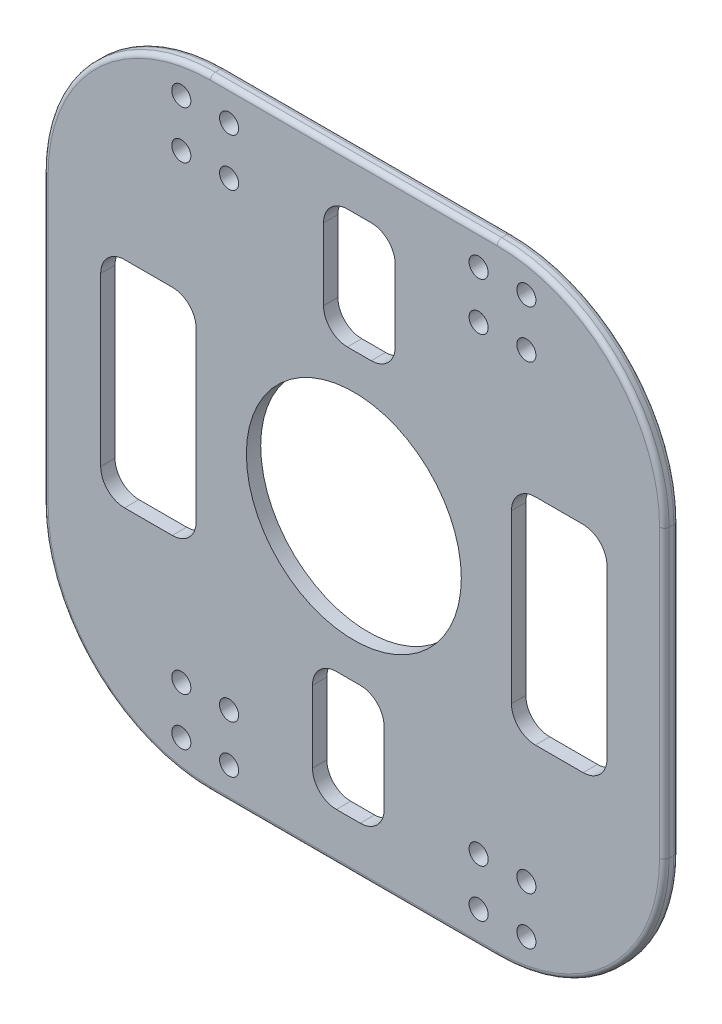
SolidWorks part; units mm, degrees
ref_plane "前视基准面" through (0, 0, 0) normal (0, 0, 1) x (1, 0, 0)
ref_plane "上视基准面" through (0, 0, 0) normal (0, 1, 0) x (1, 0, 0)
ref_plane "右视基准面" through (0, 0, 0) normal (1, 0, 0) x (0, 0, -1)
sketch "草图1" plane through (0, 0, 0) normal (0, 0, 1) x (1, 0, 0)
  line L1 (-65, 65) -> (65, 65)
  line L2 (-65, 65) -> (-65, -65)
  line L3 (-65, -65) -> (65, -65)
  line L4 (65, 65) -> (65, -65)
  line L5 (-65, 65) -> (65, -65) construction
  line L6 (-65, -65) -> (65, 65) construction
  circle A0 centre (0, 0) radius 22.5
  point P0 (0, 0)
extrude "凸台-拉伸1" add sketch "草图1" against normal blind 3
fillet "圆角1" radius 35 4 edges at (65, 65, -1.5) (-65, 65, -1.5) (65, -65, -1.5) (-65, -65, -1.5)
sketch "草图5" plane through (0, 0, -3) normal (0, 0, -1) x (-1, 0, 0)
  line L0 (0, 0) -> (0, 32.9111) construction
  line L1 (6.3448, 30) -> (6.3448, 55)
  line L2 (6.3448, 55) -> (-8.6552, 55)
  line L3 (-8.6552, 55) -> (-8.6552, 30)
  line L4 (-8.6552, 30) -> (6.3448, 30)
  line L5 (0, 0) -> (7.9061, 0) construction
  line L6 (-65, -30) -> (-65, 30) construction
  line L7 (-53, 22.5) -> (-33, 22.5)
  line L8 (-53, 22.5) -> (-53, -22.5)
  line L9 (-53, -22.5) -> (-33, -22.5)
  line L10 (-6.3448, -30) -> (-6.3448, -55)
  line L11 (-6.3448, -55) -> (8.6552, -55)
  line L12 (8.6552, -55) -> (8.6552, -30)
  line L13 (8.6552, -30) -> (-6.3448, -30)
  line L15 (-33, 22.5) -> (-33, -22.5)
  line L16 (33, 22.5) -> (33, -22.5)
  line L17 (53, -22.5) -> (33, -22.5)
  line L18 (53, 22.5) -> (53, -22.5)
  line L19 (53, 22.5) -> (33, 22.5)
  circle A1 centre (36.1191, 58.1968) radius 2
  circle A2 centre (36.1191, 58.1968) radius 2
  circle A3 centre (36.1191, 48.1968) radius 2
  circle A4 centre (36.1191, 48.1968) radius 2
  circle A7 centre (-36.1191, -58.1968) radius 2
  circle A8 centre (-36.1191, -58.1968) radius 2
  circle A15 centre (26.1191, 58.1968) radius 2
  circle A16 centre (26.1191, 58.1968) radius 2
  circle A23 centre (26.1191, 48.1968) radius 2
  circle A24 centre (26.1191, 48.1968) radius 2
  circle A33 centre (26.1191, -58.1968) radius 2
  circle A34 centre (26.1191, -58.1968) radius 2
  circle A41 centre (36.1191, -48.1968) radius 2
  circle A42 centre (36.1191, -48.1968) radius 2
  circle A43 centre (36.1191, -58.1968) radius 2
  circle A44 centre (36.1191, -58.1968) radius 2
  circle A45 centre (-36.1191, -48.1968) radius 2
  circle A46 centre (-36.1191, -48.1968) radius 2
  circle A53 centre (-26.1191, -58.1968) radius 2
  circle A54 centre (-26.1191, -58.1968) radius 2
  circle A57 centre (26.1191, -48.1968) radius 2
  circle A58 centre (26.1191, -48.1968) radius 2
  circle A63 centre (-26.1191, -48.1968) radius 2
  circle A64 centre (-26.1191, -48.1968) radius 2
  circle A83 centre (-36.1191, 48.1968) radius 2
  circle A84 centre (-36.1191, 48.1968) radius 2
  circle A85 centre (-36.1191, 58.1968) radius 2
  circle A86 centre (-36.1191, 58.1968) radius 2
  circle A91 centre (-26.1191, 58.1968) radius 2
  circle A92 centre (-26.1191, 58.1968) radius 2
  circle A93 centre (-26.1191, 48.1968) radius 2
  circle A94 centre (-26.1191, 48.1968) radius 2
  point P32 (0, 0)
  dimension "D6" = 20
  dimension "D7" = 45
  dimension "D5" = 12
  dimension "D1" = 0
  dimension "D2" = 0
  dimension "D4" = 0
  dimension "D9" = 0
  dimension "D13" = 0
  dimension "D18" = 0
  dimension "D22" = 0
  dimension "D23" = 0
  dimension "D24" = 0
  dimension "D28" = 0
  dimension "D30" = 0
  dimension "D33" = 0
  dimension "D43" = 0
  dimension "D44" = 0
  dimension "D47" = 0
  dimension "D48" = 0
extrude "切除-拉伸2" cut sketch "草图5" against normal blind 13
fillet "圆角2" radius 5 16 edges at (53, 22.5, -1.5) (33, 22.5, -1.5) (33, -22.5, -1.5) (53, -22.5, -1.5) (-6.3448, 55, -1.5) (-53, 22.5, -1.5) (-53, -22.5, -1.5) (-33, -22.5, -1.5) (-33, 22.5, -1.5) (-8.6552, -30, -1.5) (-8.6552, -55, -1.5) (6.3448, -55, -1.5) (6.3448, -30, -1.5) (-6.3448, 30, -1.5) (8.6552, 55, -1.5) (8.6552, 30, -1.5)
fillet "圆角3" radius 1 16 edges at (0, 65, 0) (54.7487, 54.7487, 0) (65, 0, 0) (54.7487, -54.7487, 0) (0, -65, 0) (-54.7487, -54.7487, 0) (-65, 0, 0) (-65, 0, -3) (-54.7487, -54.7487, -3) (0, -65, -3) (54.7487, -54.7487, -3) (65, 0, -3) (54.7487, 54.7487, -3) (0, 65, -3) (-54.7487, 54.7487, 0) (-54.7487, 54.7487, -3)
